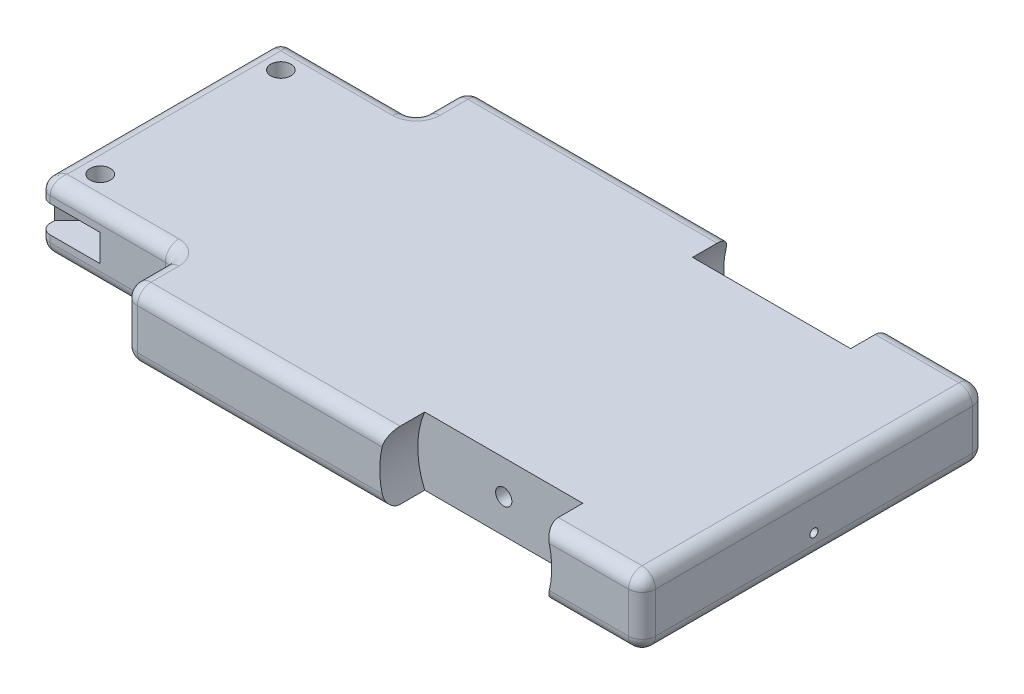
SolidWorks part; units mm, degrees
ref_plane "Front Plane" through (0, 0, 0) normal (0, 0, 1) x (1, 0, 0)
ref_plane "Top Plane" through (0, 0, 0) normal (0, 1, 0) x (1, 0, 0)
ref_plane "Right Plane" through (0, 0, 0) normal (1, 0, 0) x (0, 0, -1)
other "Center of Mass"
ref_plane "plane steering B" through (-432.6, 0, 0) normal (1, 0, 0) x (0, 0, -1)
ref_plane "plane steering A" through (0, 50, 0) normal (0, 1, 0) x (1, 0, 0)
sketch "Sketch chassis body" plane through (0, 0, 0) normal (0, 1, 0) x (1, 0, 0)
  line L1 (-482.6, 254) -> (482.6, 254)
  line L2 (-482.6, 254) -> (-482.6, -254)
  line L3 (-482.6, -254) -> (482.6, -254)
  line L4 (482.6, 254) -> (482.6, -254)
  line L5 (-482.6, 254) -> (482.6, -254) construction
  line L6 (-482.6, -254) -> (482.6, 254) construction
  point P0 (0, 0)
  dimension "D1" = 965.2
  dimension "D2" = 508
extrude "full chassis body" add sketch "Sketch chassis body" along normal blind 100
sketch "Sketch rear shaft space" plane through (0, 0, 254) normal (0, 0, 1) x (1, 0, 0)
  line L0 (482.6, 50) -> (222.25, 50) construction
  line L1 (482.6, 100) -> (482.6, 0) construction
  circle A0 centre (222.25, 50) radius 127
  dimension "D2" = 254
  dimension "D1" = 260.35
extrude "space rear wheel" cut sketch "Sketch rear shaft space" against normal blind 56.2
mirror "space rear wheel 2" about plane through (0, 0, 0) normal (0, 0, 1) of "space rear wheel"
sketch "Sketch shaft rear wheel" plane through (0, 0, 197.8) normal (0, 0, 1) x (1, 0, 0)
  line L0 (482.6, 100) -> (482.6, 0) construction
  line L2 (222.25, 50) -> (482.6, 50) construction
  circle A1 centre (222.25, 50) radius 12
  dimension "D2" = 24
  dimension "D1" = 260.35
extrude "rear shaft wheels" cut sketch "Sketch shaft rear wheel" against normal up to surface (395.6 mm away)
sketch "Sketch space front shaft" plane through (0, 50, 0) normal (0, 1, 0) x (1, 0, 0)
  line L10 (-482.6, 0) -> (-482.6, -88.9) construction
  line L12 (-482.6, 254) -> (-482.6, -254) construction
  line L18 (-482.6, -88.9) -> (-393.7, -88.9)
  line L19 (-482.6, -88.9) -> (-482.6, -177.8)
  line L20 (-482.6, -177.8) -> (-393.7, -177.8)
  line L21 (-393.7, -88.9) -> (-393.7, -177.8)
  dimension "D1" = 88.9
  dimension "D2" = 88.9
  dimension "D3" = 88.9
sketch "Sketch space front wheel " plane through (-482.6, 0, 0) normal (-1, 0, 0) x (0, 0, 1)
  line L0 (-254, 0) -> (254, 0) construction
  line L1 (254, 100) -> (177.8, 100)
  line L2 (254, 100) -> (254, 0)
  line L3 (254, 0) -> (177.8, 0)
  line L4 (177.8, 100) -> (177.8, 0)
  dimension "D1" = 76.2
extrude "space for front wheel" cut sketch "Sketch space front wheel " against normal blind 200
mirror "space for front wheel 2" about plane through (0, 0, 0) normal (0, 0, 1) of "space for front wheel"
extrude "space front shaft" cut sketch "Sketch space front shaft" against normal mid plane 40
mirror "space front shaft 2" about plane through (0, 0, 0) normal (0, 0, 1) of "space front shaft"
sketch "Sketch hole front shaft" plane through (0, 70, 0) normal (0, -1, 0) x (1, 0, 0)
  line L0 (-482.6, 133.35) -> (-438.15, 133.35) construction
  line L1 (-438.15, 133.35) -> (-438.15, 177.8) construction
  circle A0 centre (-438.15, 133.35) radius 15
  dimension "D3" = 30
  dimension "D2" = 44.45
  dimension "D1" = 44.45
extrude "hole front shaft" cut sketch "Sketch hole front shaft" against normal up to surface (30 mm away)
mirror "hole front shaft 2" about plane through (0, 0, 0) normal (0, 0, 1) of "hole front shaft"
fillet "Front fillets" radius 15 6 edges at (-282.6, 50, -177.8) (-282.6, 50, 177.8) (-482.6, 15, -177.8) (-482.6, 85, -177.8) (-482.6, 15, 177.8) (-482.6, 85, 177.8)
sketch "Sketch angle limit section" plane through (0, 30, 0) normal (0, 1, 0) x (1, 0, 0)
  line L3 (-55, 0) -> (55, 0) construction
  line L16 (-482.6, -88.9) -> (-482.6, -156.5868)
  line L17 (-393.7, -88.9) -> (-482.6, -88.9)
  line L18 (-438.15, -133.35) -> (-448.7566, -122.7434) construction
  line L19 (-482.6, -156.5868) -> (-448.7566, -122.7434)
  line L20 (-393.7, -118.35) -> (-393.7, -88.9)
  line L21 (-438.15, -118.35) -> (-393.7, -118.35)
  arc A0 (-448.7566, -122.7434) -> (-438.15, -118.35) centre (-438.15, -133.35) cw
  circle A1 centre (-438.15, 133.35) radius 15 construction
extrude "angle limit section" add sketch "Sketch angle limit section" along normal up to surface (40 mm away)
mirror "angle limit section 2" about plane through (0, 0, 0) normal (0, 0, 1) of "angle limit section"
fillet "extra fillets" radius 20 32 edges at (410.7967, 0, -254) (410.7967, 0, 254) (410.7967, 100, -254) (410.7967, 100, 254) (482.6, 0, 0) (482.6, 100, 0) (482.6, 50, -254) (482.6, 50, 254) (-282.6, 50, -254) (-282.6, 50, 254) (-282.6, 0, -223.4) (-286.9934, 0, -182.1934) (-382.6, 0, -177.8) (-478.2066, 0, -173.4066) (-282.6, 0, 223.4) (-286.9934, 0, 182.1934) (-382.6, 0, 177.8) (-478.2066, 0, 173.4066) (-282.6, 100, -223.4) (-286.9934, 100, -182.1934) (-382.6, 100, -177.8) (-478.2066, 100, -173.4066) (-282.6, 100, 223.4) (-286.9934, 100, 182.1934) (-382.6, 100, 177.8) (-478.2066, 100, 173.4066) (-482.6, 0, 0) (-482.6, 100, 0) (-88.5467, 0, -254) (-88.5467, 100, -254) (-88.5467, 0, 254) (-88.5467, 100, 254)
sketch "Sketch2" plane through (482.6, 0, 0) normal (1, 0, 0) x (0, 0, -1)
  line L0 (0, 0) -> (0, 35) construction
  line L1 (0, 55) -> (0, -55) construction
  circle A0 centre (0, 35) radius 6
  dimension "D2" = 12
  dimension "D1" = 35
extrude "Cut-Extrude1" cut sketch "Sketch2" against normal blind 15
sketch "Sketch connection to top vehicle" plane through (0, 100, 0) normal (0, 1, 0) x (1, 0, 0)
  circle A0 centre (0, 0) radius 20
other "Center of Mass Reference Point1"
